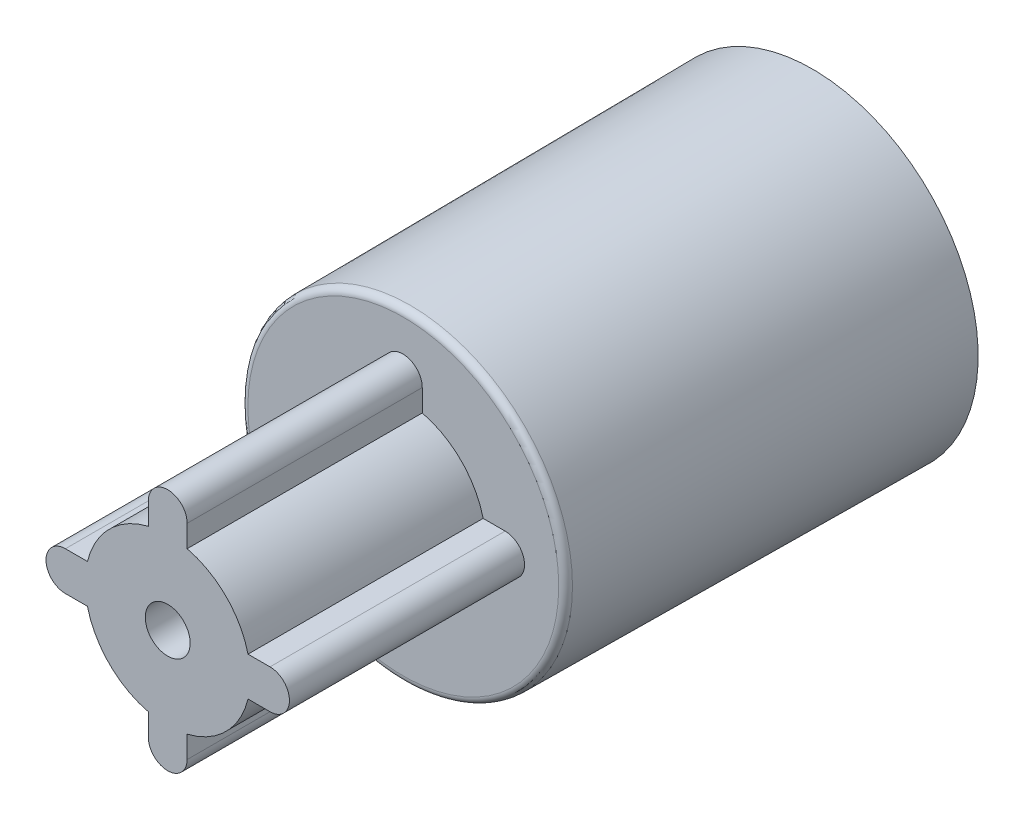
SolidWorks part; units mm, degrees
ref_plane "Plane1" through (0, 0, 0) normal (0, 0, 1) x (1, 0, 0)
ref_plane "Plane2" through (0, 0, 0) normal (0, 1, 0) x (1, 0, 0)
ref_plane "Plane3" through (0, 0, 0) normal (1, 0, 0) x (0, 0, -1)
imported_body "Imported1"
sketch "Sketch1" plane through (0, 0, 0) normal (0, 1, 0) x (1, 0, 0)
  line L0 (-16.8933, -39.7) -> (13.8813, -39.7)
  line L1 (-16.8933, -39.7) -> (-16.8933, -37.32)
  line L2 (13.8813, -37.32) -> (-16.8933, -37.32)
  line L3 (13.8813, -37.32) -> (13.8813, -39.7)
  line L4 (0.6987, -39.7) -> (4.2983, -39.7) construction
  dimension "D1" = 2.38
extrude "Cut-Extrude1" cut sketch "Sketch1" against normal through all and the other way through all
